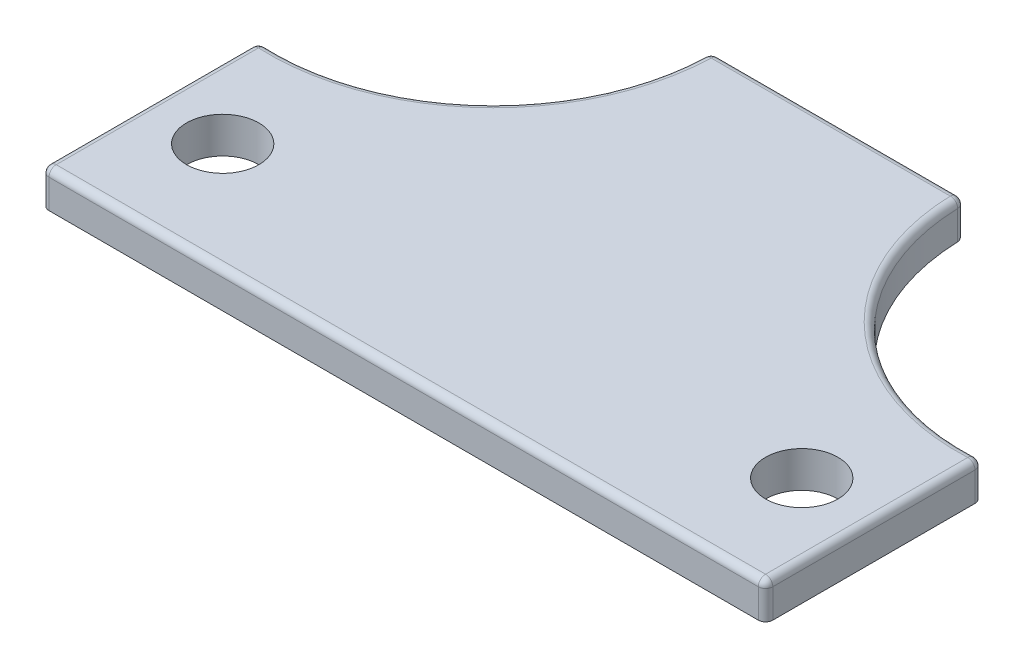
SolidWorks part; units mm, degrees
ref_plane "Front Plane" through (0, 0, 0) normal (0, 0, 1) x (1, 0, 0)
ref_plane "Top Plane" through (0, 0, 0) normal (0, 1, 0) x (1, 0, 0)
ref_plane "Right Plane" through (0, 0, 0) normal (1, 0, 0) x (0, 0, -1)
sketch "Sketch1" plane through (0, 0, 0) normal (0, 1, 0) x (1, 0, 0)
  line L0 (0, 9.0795) -> (0, 1.5) construction
  line L1 (5, 0) -> (-5, 0)
  line L2 (-5, 0) -> (-5, 3)
  line L3 (-1.75, 6) -> (1.75, 6)
  line L4 (5, 0) -> (5, 3)
  line L5 (4, 1.5) -> (-4, 1.5) construction
  arc A0 (-5, 3) -> (-1.75, 6) centre (-4.7596, 6) ccw
  arc A1 (5, 3) -> (1.75, 6) centre (4.7596, 6) cw
  circle A2 centre (-4, 1.5) radius 0.5
  circle A3 centre (4, 1.5) radius 0.5
  point P12 (0, 6)
  point P13 (0, 0)
  dimension "D5" = 1
  dimension "D6" = 1
  dimension "D1" = 10
  dimension "D2" = 3
  dimension "D3" = 6
  dimension "D4" = 3.5
  dimension "D7" = 8
  dimension "D8" = 1.5
extrude "Boss-Extrude1" add sketch "Sketch1" along normal blind 0.5
fillet "Fillet1" radius 0.1 13 edges at (1.75, 0.25, -6) (0, 0.5, -6) (-1.75, 0.25, -6) (0, 0, -6) (5, 0.25, -3) (5, 0.25, 0) (-5, 0.25, 0) (-5, 0.25, -3) (2.7183, 0.5, -3.7885) (5, 0.5, -1.5) (0, 0.5, 0) (-5, 0.5, -1.5) (-2.7183, 0.5, -3.7885)
